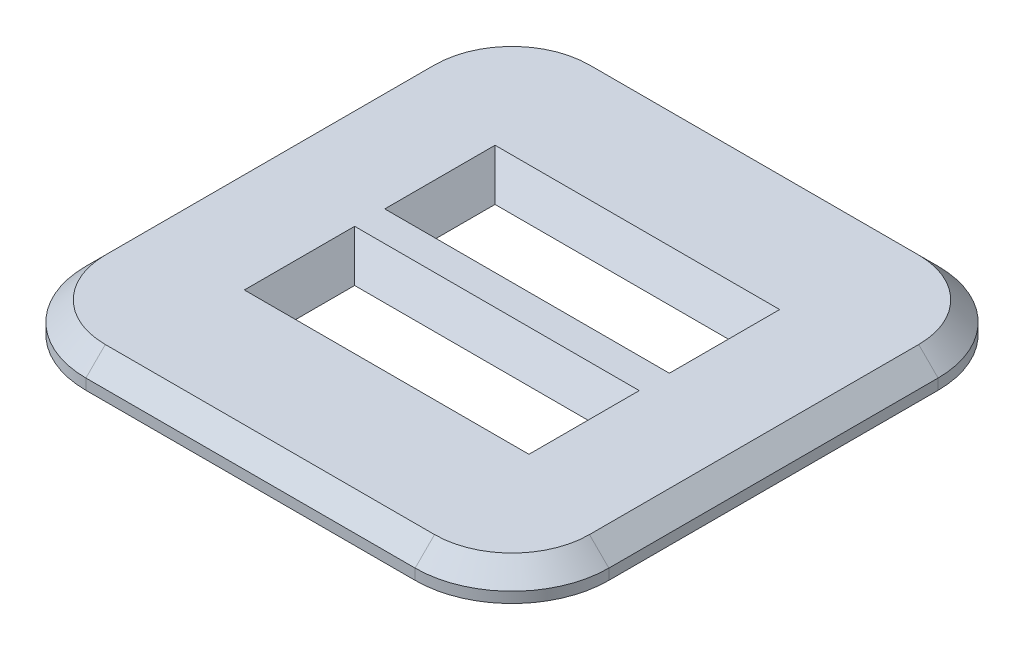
SolidWorks part; units mm, degrees
ref_plane "Front Plane" through (0, 0, 0) normal (0, 0, 1) x (1, 0, 0)
ref_plane "Top Plane" through (0, 0, 0) normal (0, 1, 0) x (1, 0, 0)
ref_plane "Right Plane" through (0, 0, 0) normal (1, 0, 0) x (0, 0, -1)
sketch "Sketch1" plane through (0, 0, 0) normal (0, 1, 0) x (1, 0, 0)
  line L1 (2.7, 2.7) -> (-2.7, 2.7)
  line L2 (2.7, 2.7) -> (2.7, -2.7)
  line L3 (2.7, -2.7) -> (-2.7, -2.7)
  line L4 (-2.7, 2.7) -> (-2.7, -2.7)
  line L5 (2.7, 2.7) -> (-2.7, -2.7) construction
  line L6 (2.7, -2.7) -> (-2.7, 2.7) construction
  point P0 (0, 0)
  dimension "D1" = 5.4
  dimension "D2" = 5.4
extrude "Boss-Extrude1" add sketch "Sketch1" along normal blind 0.31
fillet "Fillet1" radius 1 4 edges at (-2.7, 0.155, -2.7) (2.7, 0.155, -2.7) (2.7, 0.155, 2.7) (-2.7, 0.155, 2.7)
chamfer "Chamfer1" distance 0.2 angle 45 8 edges at (2.4071, 0.31, 2.4071) (0, 0.31, 2.7) (-2.4071, 0.31, 2.4071) (-2.7, 0.31, 0) (-2.4071, 0.31, -2.4071) (0, 0.31, -2.7) (2.4071, 0.31, -2.4071) (2.7, 0.31, 0)
sketch "Sketch2" plane through (0, 0.31, 0) normal (0, 1, 0) x (1, 0, 0)
  line L1 (1.25, 1.075) -> (-1.25, 1.075)
  line L2 (1.25, 1.075) -> (1.25, 0.375)
  line L3 (1.25, 0.375) -> (-1.25, 0.375)
  line L4 (-1.25, 1.075) -> (-1.25, 0.375)
  line L5 (1.25, 1.075) -> (-1.25, 0.375) construction
  line L6 (1.25, 0.375) -> (-1.25, 1.075) construction
  line L7 (-1.7, 2.7) -> (1.7, 2.7) construction
  line L8 (-2.5, 0) -> (2.5, 0) construction
  line L9 (-2.5, 1.7) -> (-2.5, -1.7) construction
  line L10 (2.5, -1.7) -> (2.5, 1.7) construction
  line L11 (1.25, -0.375) -> (-1.25, -0.375)
  line L12 (-1.25, -1.075) -> (-1.25, -0.375)
  line L13 (1.25, -1.075) -> (-1.25, -1.075)
  line L14 (1.25, -1.075) -> (1.25, -0.375)
  line L15 (2.7, 1.7) -> (2.7, -1.7) construction
  point P0 (0, 0)
  point P20 (0, 0.725)
  dimension "D1" = 2.5
  dimension "D2" = 0.7
  dimension "D3" = 1.625
  dimension "D4" = 2.7
extrude "Cut-Extrude1" cut sketch "Sketch2" against normal through all
chamfer "Chamfer2" distance 0.31 angle 35.3 8 edges at (1.25, 0.31, -0.725) (0, 0.31, -0.375) (-1.25, 0.31, -0.725) (0, 0.31, -1.075) (-1.25, 0.31, 0.725) (0, 0.31, 1.075) (1.25, 0.31, 0.725) (0, 0.31, 0.375)
